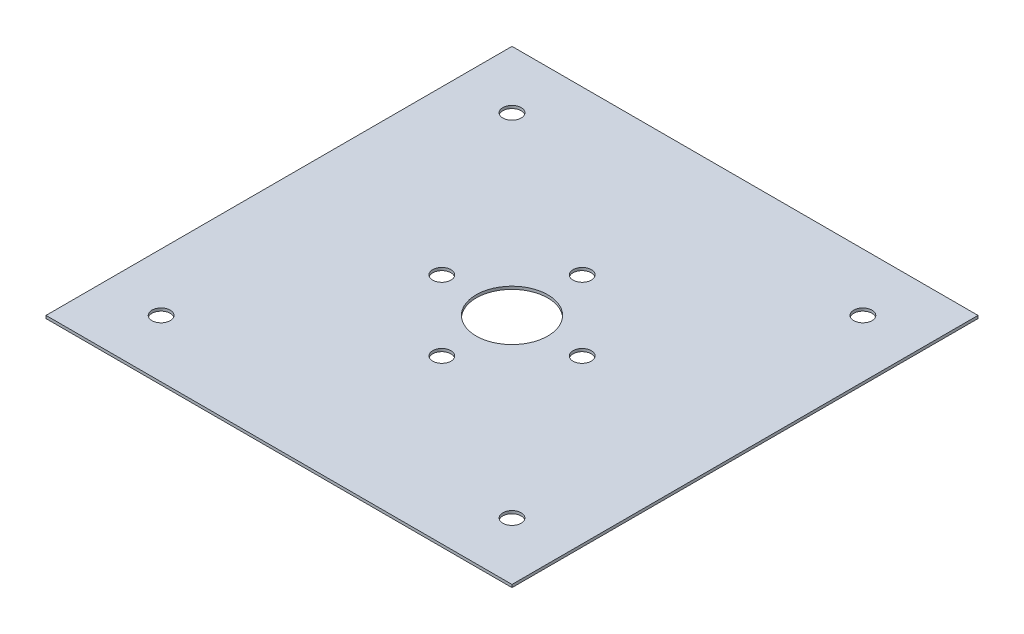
SolidWorks part; units mm, degrees
ref_plane "Front Plane" through (0, 0, 0) normal (0, 0, 1) x (1, 0, 0)
ref_plane "Top Plane" through (0, 0, 0) normal (0, 1, 0) x (1, 0, 0)
ref_plane "Right Plane" through (0, 0, 0) normal (1, 0, 0) x (0, 0, -1)
sketch "Sketch1" plane through (0, 0, 0) normal (0, 1, 0) x (1, 0, 0)
  line L0 (0, -1000) -> (0, 49000) construction
  line L1 (-166, 166) -> (166, 166)
  line L2 (-166, 166) -> (-166, -166)
  line L3 (-166, -166) -> (166, -166)
  line L4 (166, 166) -> (166, -166)
  line L5 (-166, 166) -> (166, -166) construction
  line L6 (-166, -166) -> (166, 166) construction
  line L7 (-1000, 0) -> (49000, 0) construction
  circle A0 centre (-125, 125) radius 6.5
  circle A1 centre (125, 125) radius 6.5
  circle A2 centre (125, -125) radius 6.5
  circle A3 centre (-125, -125) radius 6.5
  circle A4 centre (0, 0) radius 25.5
  circle A5 centre (-50, 0) radius 6.5
  circle A6 centre (0, 50) radius 6.5
  circle A7 centre (50, 0) radius 6.5
  circle A8 centre (0, -50) radius 6.5
  point P0 (0, 0)
  point P31 (0, 0)
  dimension "D3" = 51
  dimension "D4" = 13
  dimension "D5" = 13
  dimension "D1" = 332
  dimension "D2" = 41
  dimension "D6" = 50
  dimension "D7" = 4
extrude "Boss-Extrude1" add sketch "Sketch1" along normal blind 2
